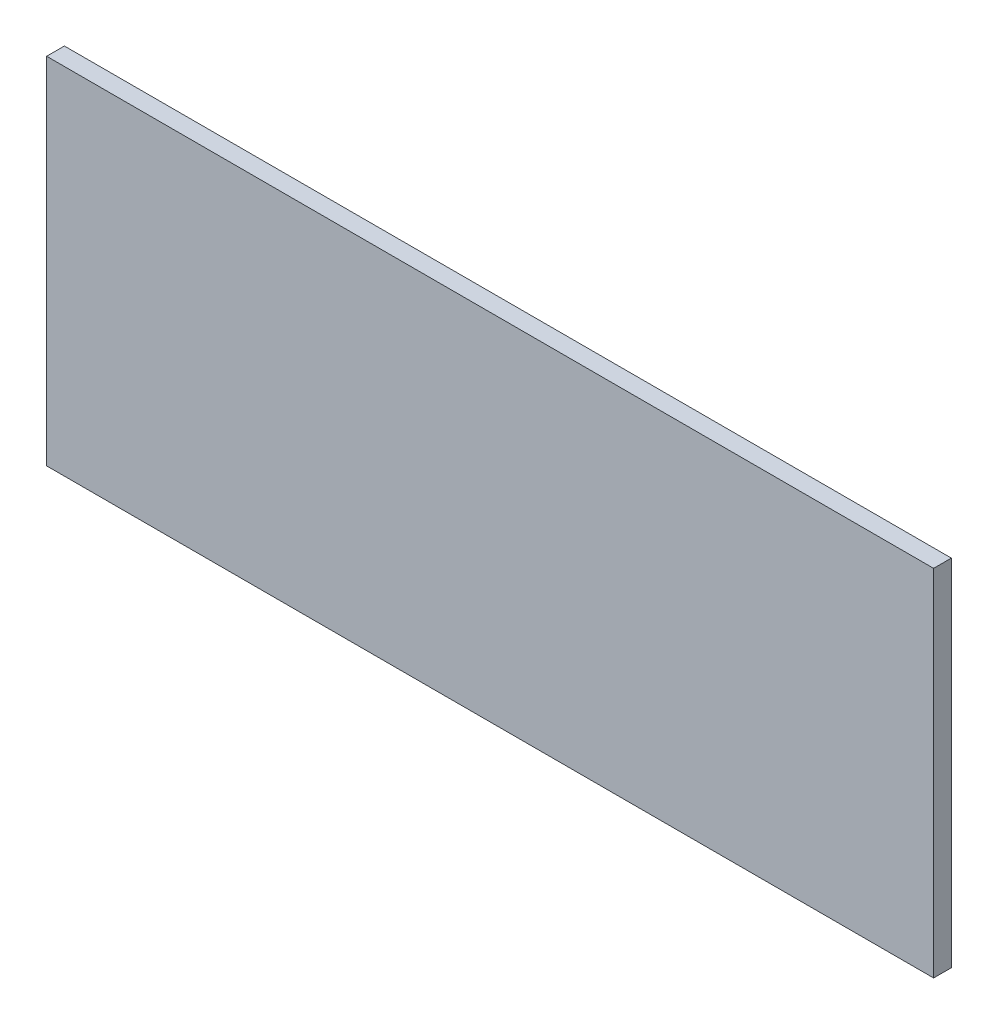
SolidWorks part; units mm, degrees
ref_plane "Alzado" through (0, 0, 0) normal (0, 0, 1) x (1, 0, 0)
ref_plane "Planta" through (0, 0, 0) normal (0, 1, 0) x (1, 0, 0)
ref_plane "Vista lateral" through (0, 0, 0) normal (1, 0, 0) x (0, 0, -1)
sketch "Croquis1" plane through (0, 0, 0) normal (0, 0, 1) x (1, 0, 0)
  line L0 (-125, 50) -> (125, -50) construction
  line L1 (-125, 50) -> (125, 50)
  line L2 (-125, 50) -> (-125, -50)
  line L3 (-125, -50) -> (125, -50)
  line L4 (125, 50) -> (125, -50)
  dimension "D1" = 250
  dimension "D2" = 100
extrude "Extruir1" add sketch "Croquis1" along normal blind 5
